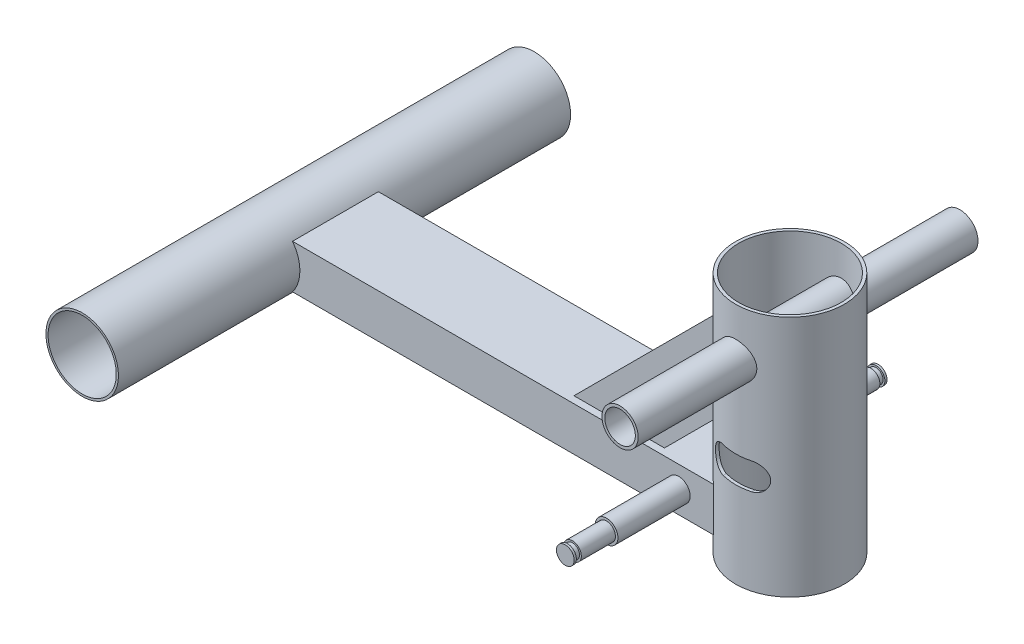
SolidWorks part; units mm, degrees
ref_plane "Plan1" through (0, 0, 0) normal (0, 0, 1) x (1, 0, 0)
ref_plane "Plan2" through (0, 0, 0) normal (0, 1, 0) x (1, 0, 0)
ref_plane "Plan3" through (0, 0, 0) normal (1, 0, 0) x (0, 0, -1)
sketch "Esquisse1" plane through (0, 0, 0) normal (0, 0, 1) x (1, 0, 0)
  circle A0 centre (0, 0) radius 25.5
  circle A1 centre (0, 0) radius 24
  dimension "D1" = 51
  dimension "D2" = 48
extrude "Base-Extrusion" add sketch "Esquisse1" along normal blind 318
ref_plane "Plan4" through (303, 0, 0) normal (1, 0, 0) x (0, 0, -1)
sketch "Esquisse3" plane through (303, 0, 0) normal (1, 0, 0) x (0, 0, -1)
  line L0 (-190.4, 15.4) -> (-190.4, -15.4)
  line L1 (-190.4, -15.4) -> (-130, -15.4)
  line L2 (-130, -15.4) -> (-130, 15.4)
  line L3 (-130, 15.4) -> (-190.4, 15.4)
  line L4 (0, 50) -> (0, -50) construction
  line L5 (0, 25.5) -> (-318, 25.5) construction
  line L7 (-131, 14.4) -> (-189.4, 14.4)
  line L8 (-131, -14.4) -> (-131, 14.4)
  line L9 (-189.4, -14.4) -> (-131, -14.4)
  line L10 (-189.4, 14.4) -> (-189.4, -14.4)
  dimension "D1" = 60.4
  dimension "D2" = 30.8
  dimension "D3" = 130
  dimension "D4" = 10.1
  dimension "D5" = 1
extrude "Boss.-Extru.3" add sketch "Esquisse3" along normal up to surface (282.6754 mm away)
ref_plane "Plan6" through (223, 0, 0) normal (1, 0, 0) x (0, 0, -1)
ref_plane "Plan7" through (0, -29.6, 0) normal (0, 1, 0) x (-1, 0, 0)
sketch "Esquisse8" plane through (0, -29.6, 0) normal (0, 1, 0) x (-1, 0, 0)
  line L1 (-303, 130) -> (-303, 190.4) construction
  circle A0 centre (-340, 160.2) radius 38.25
  circle A1 centre (-340, 160.2) radius 36.1
  dimension "D3" = 76.5
  dimension "D4" = 72.2
  dimension "D1" = 30.2
  dimension "D2" = 37
extrude "Boss.-Extru.6" add sketch "Esquisse8" along normal blind 170.5
sketch "Esquisse10" plane through (223, 0, 0) normal (1, 0, 0) x (0, 0, -1)
  line L0 (-190.4, 15.4) -> (-190.4, -15.4)
  line L1 (-190.4, -15.4) -> (-130, -15.4)
  line L2 (-130, -15.4) -> (-130, 15.4)
  line L3 (-130, 15.4) -> (-190.4, 15.4)
  line L4 (-190.4, 15.4) -> (-190.4, -15.4) construction
  line L5 (-169.8986, 15.4) -> (-190.4, 15.4) construction
  line L6 (-190.4, -15.4) -> (-169.8986, -15.4) construction
  line L7 (-130, -15.4) -> (-130, 15.4) construction
  line L8 (-189.4, -14.4) -> (-131, -14.4)
  line L9 (-189.4, 14.4) -> (-189.4, -14.4)
  line L10 (-131, 14.4) -> (-189.4, 14.4)
  line L11 (-131, -14.4) -> (-131, 14.4)
  dimension "D1" = 1
extrude "Boss.-Extru.7" add sketch "Esquisse10" along normal up to surface (93.5261 mm away)
sketch "Esquisse11" plane through (0, 0, 0) normal (0, 0, 1) x (1, 0, 0)
  line L0 (330, 49.8) -> (350, 49.8)
  line L1 (330, 31) -> (350, 31)
  line L4 (301.75, 140.9) -> (301.75, 15.4) construction
  line L7 (301.75, -29.6) -> (378.25, -29.6) construction
  arc A0 (330, 49.8) -> (330, 31) centre (330, 40.4) ccw
  arc A1 (350, 49.8) -> (350, 31) centre (350, 40.4) cw
  dimension "D1" = 18.8
  dimension "D2" = 20
  dimension "D3" = 28.25
  dimension "D4" = 70
extrude "Enlèv. mat.-Extru.2" cut sketch "Esquisse11" along normal through all
ref_plane "Plan8" through (0, 0, 160.2) normal (0, 0, 1) x (1, 0, 0)
ref_plane "Plan9" through (0, 0, 190.4) normal (0, 0, 1) x (1, 0, 0)
sketch "Esquisse17" plane through (0, 0, 160.2) normal (0, 0, 1) x (1, 0, 0)
  line L0 (340, 49.8) -> (340, 31) construction
  line L1 (378.25, 140.9) -> (301.75, 140.9) construction
  circle A0 centre (340, 106.9) radius 12.75
  dimension "D2" = 25.5
  dimension "D1" = 34
extrude "Boss.-Extru.9" add sketch "Esquisse17" along normal mid plane 239
sketch "Esquisse18" plane through (0, 0, 160.2) normal (0, 0, 1) x (1, 0, 0)
  line L0 (50, 0) -> (-50, 0) construction
  line L1 (292, -108) -> (292, 216) construction
  circle A0 centre (292, 0) radius 8
  dimension "D1" = 16
extrude "Boss.-Extru.10" add sketch "Esquisse18" along normal mid plane 162
sketch "Esquisse19" plane through (0, 0, 241.2) normal (0, 0, 1) x (1, 0, 0)
  circle A0 centre (292, 0) radius 6.25
  dimension "D1" = 12.5
extrude "Boss.-Extru.11" add sketch "Esquisse19" along normal blind 24
sketch "Esquisse20" plane through (0, 0, 265.2) normal (0, 0, 1) x (1, 0, 0)
  circle A0 centre (292, 0) radius 5
  dimension "D1" = 10
extrude "Boss.-Extru.12" add sketch "Esquisse20" along normal blind 3.5
sketch "Esquisse21" plane through (0, 0, 268.7) normal (0, 0, 1) x (1, 0, 0)
  circle A0 centre (292, 0) radius 6.25
  dimension "D1" = 12.5
extrude "Boss.-Extru.13" add sketch "Esquisse21" along normal blind 1.5
sketch "Esquisse22" plane through (0, 0, 79.2) normal (0, 0, -1) x (-1, 0, 0)
  circle A0 centre (-292, 0) radius 6.25
  circle A1 centre (-292, 0) radius 6.25 construction
extrude "Boss.-Extru.14" add sketch "Esquisse22" along normal blind 24
sketch "Esquisse23" plane through (0, 0, 55.2) normal (0, 0, -1) x (-1, 0, 0)
  circle A0 centre (-292, 0) radius 5
  circle A1 centre (-292, 0) radius 5 construction
extrude "Boss.-Extru.15" add sketch "Esquisse23" along normal blind 3.5
sketch "Esquisse24" plane through (0, 0, 51.7) normal (0, 0, -1) x (-1, 0, 0)
  circle A0 centre (-292, 0) radius 6.25
  circle A2 centre (-292, 0) radius 6.25 construction
extrude "Boss.-Extru.16" add sketch "Esquisse24" along normal blind 1.5
ref_plane "Plan12" through (17.8623, 17.8623, 0) normal (0.7071, 0.7071, 0) x (0, 0, -1)
ref_plane "Plan13" through (159.2837, 159.2837, 0) normal (0.7071, 0.7071, 0) x (0, 0, -1)
sketch "Esquisse25" plane through (159.2837, 159.2837, 0) normal (0.7071, 0.7071, 0) x (0, 0, -1)
  line L0 (-185.5, -185) -> (-185.5, -140)
  line L1 (-185.5, -140) -> (-135, -140)
  line L2 (-135, -140) -> (-135, -185)
  line L3 (-136, -141) -> (-136, -185)
  line L4 (-184.5, -141) -> (-136, -141)
  line L5 (-184.5, -185) -> (-184.5, -141)
  line L6 (-184.5, -185) -> (-185.5, -185)
  line L7 (-135, -185) -> (-136, -185)
  dimension "D1" = 1
extrude "Boss.-Extru.19" add sketch "Esquisse25" along normal up to surface (18.4822 mm away)
sketch "Esquisse26" plane through (159.2837, 159.2837, 0) normal (0.7071, 0.7071, 0) x (0, 0, -1)
  line L0 (-185.5, -185) -> (-185.5, -140)
  line L1 (-185.5, -140) -> (-135, -140)
  line L2 (-135, -140) -> (-135, -185)
  line L3 (-185.5, -185) -> (-184.5, -185)
  line L4 (-135, -185) -> (-136, -185)
  line L5 (-184.5, -185) -> (-184.5, -141)
  line L6 (-184.5, -141) -> (-136, -141)
  line L7 (-136, -141) -> (-136, -185)
extrude "Boss.-Extru.20" add sketch "Esquisse26" along normal up to surface (75.0012 mm away)
sketch "Esquisse27" plane through (0, 0, 40.7) normal (0, 0, -1) x (-1, 0, 0)
  circle A0 centre (-340, 106.9) radius 10.75
  dimension "D1" = 21.5
extrude "Enlèv. mat.-Extru.3" cut sketch "Esquisse27" against normal through all
